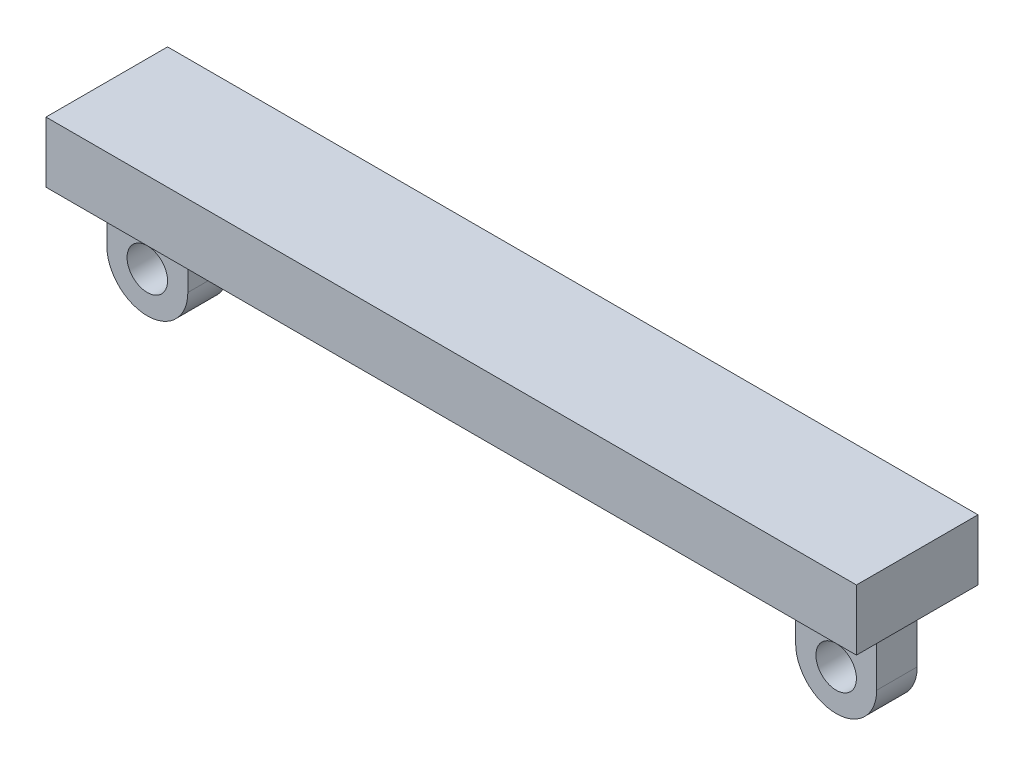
SolidWorks part; units mm, degrees
ref_plane "Front Plane" through (0, 0, 0) normal (0, 0, 1) x (1, 0, 0)
ref_plane "Top Plane" through (0, 0, 0) normal (0, 1, 0) x (1, 0, 0)
ref_plane "Right Plane" through (0, 0, 0) normal (1, 0, 0) x (0, 0, -1)
sketch "Sketch1" plane through (0, 0, 0) normal (0, 1, 0) x (1, 0, 0)
  line L0 (0, 0) -> (0, 95.1694) construction
  line L1 (0, 0) -> (117.2377, 0) construction
  line L3 (-200, 30) -> (200, 30)
  line L4 (-200, 30) -> (-200, -30)
  line L5 (-200, -30) -> (200, -30)
  line L6 (200, 30) -> (200, -30)
  dimension "D1" = 400
  dimension "D2" = 200
  dimension "D3" = 60
  dimension "D4" = 30
extrude "Extrude1" add sketch "Sketch1" against normal blind 30
sketch "Sketch2" plane through (0, -30, 0) normal (0, -1, 0) x (1, 0, 0)
  line L0 (0, 0) -> (-219.0879, 0) construction
  line L1 (-170, 10) -> (-170, -10) construction
  line L2 (-190, -10) -> (-150, -10)
  line L3 (-190, -10) -> (-190, 10)
  line L4 (-190, 10) -> (-150, 10)
  line L5 (-150, -10) -> (-150, 10)
  line L6 (0, 0) -> (0, -104.2356) construction
  dimension "D1" = 40
  dimension "D2" = 20
  dimension "D3" = 20
  dimension "D4" = 10
  dimension "D5" = 340
extrude "Extrude2" add sketch "Sketch2" along normal blind 50
fillet "Fillet1" radius 20 4 edges at (-190, -80, 0) (-170, -80, -10) (-150, -80, 0) (-170, -80, 10)
sketch "Sketch3" plane through (0, 0, -10) normal (0, 0, -1) x (1, 0, 0)
  circle A0 centre (-170, 60) radius 10
  arc A1 (-170, 80) -> (-190, 60) centre (-170, 60) ccw construction
  dimension "D1" = 20
extrude "Cut-Extrude1" cut sketch "Sketch3" against normal through all
fillet "Fillet2" radius 5 2 edges at (-190, -30, 0) (-150, -30, 0)
mirror "Mirror1" about plane through (0, 0, 0) normal (1, 0, 0) of "Fillet2", "Extrude2", "Fillet1", "Cut-Extrude1"
equation "\"D2@Sketch1\" = \"D1@Sketch1\"/2"
equation "\"D4@Sketch1\" = \"D3@Sketch1\"/2"
equation "\"D2@Sketch2\" = \"D1@Sketch2\"/2"
